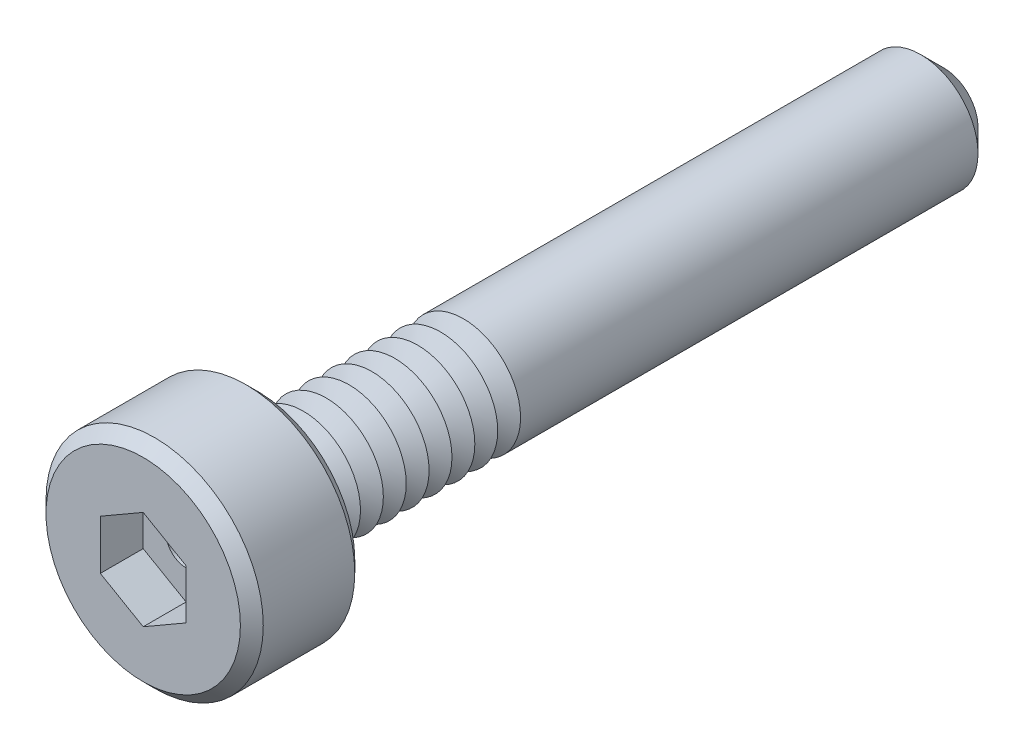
SolidWorks part; units mm, degrees
ref_plane "Front Plane" through (0, 0, 0) normal (0, 0, 1) x (1, 0, 0)
ref_plane "Top Plane" through (0, 0, 0) normal (0, 1, 0) x (1, 0, 0)
ref_plane "Right Plane" through (0, 0, 0) normal (1, 0, 0) x (0, 0, -1)
sketch "Sketch1" plane through (0, 0, 0) normal (0, 0, 1) x (1, 0, 0)
  circle A0 centre (0, 0) radius 1.9
  dimension "D1" = 3.8
extrude "Boss-Extrude1" add sketch "Sketch1" along normal blind 2
sketch "Sketch2" plane through (0, 0, 0) normal (0, 0, -1) x (-1, 0, 0)
  circle A0 centre (0, 0) radius 1
  dimension "D1" = 2
extrude "Boss-Extrude2" add sketch "Sketch2" along normal blind 12
chamfer "Chamfer1" distance 0.4 angle 45 1 edges at (-1, 0, -12)
sketch "Sketch3" plane through (0, 0, 0) normal (1, 0, 0) x (0, 0, -1)
  line L0 (-2.5121, 0) -> (4.5776, 0) construction
sketch "Sketch4" plane through (0, 0, 0) normal (1, 0, 0) x (0, 0, -1)
  line L0 (0, 1) -> (0.2, 0.6536)
  line L1 (0.2, 0.6536) -> (0.4, 1)
  line L2 (11.6, 1) -> (0, 1) construction
  line L3 (0.4, 1) -> (0, 1)
  dimension "D1" = 0.4
revolve "Cut-Revolve1" cut sketch "Sketch4" angle 360 about L0
pattern_linear "LPattern1" count 9 spacing 0.4 along (0, 0, -1) of "Cut-Revolve1"
sketch "Sketch5" plane through (0, 0, 2) normal (0, 0, 1) x (1, 0, 0)
  line L1 (0, 0.866) -> (-0.75, 0.433)
  line L2 (-0.75, 0.433) -> (-0.75, -0.433)
  line L3 (-0.75, -0.433) -> (0, -0.866)
  line L4 (0, -0.866) -> (0.75, -0.433)
  line L5 (0.75, -0.433) -> (0.75, 0.433)
  line L6 (0.75, 0.433) -> (0, 0.866)
  circle A0 centre (0, 0) radius 0.75 construction
  dimension "D1" = 1.5
extrude "Cut-Extrude1" cut sketch "Sketch5" against normal blind 0.75
sketch "Sketch6" plane through (0, 0, 1.25) normal (0, 0, 1) x (1, 0, 0)
  circle A0 centre (0, 0) radius 0.35
  dimension "D1" = 0.7
extrude "Cut-Extrude2" cut sketch "Sketch6" against normal up to surface (13.25 mm away)
chamfer "Chamfer2" distance 0.2 angle 45 2 edges at (1.9, 0, 0) (1.9, 0, 2)
